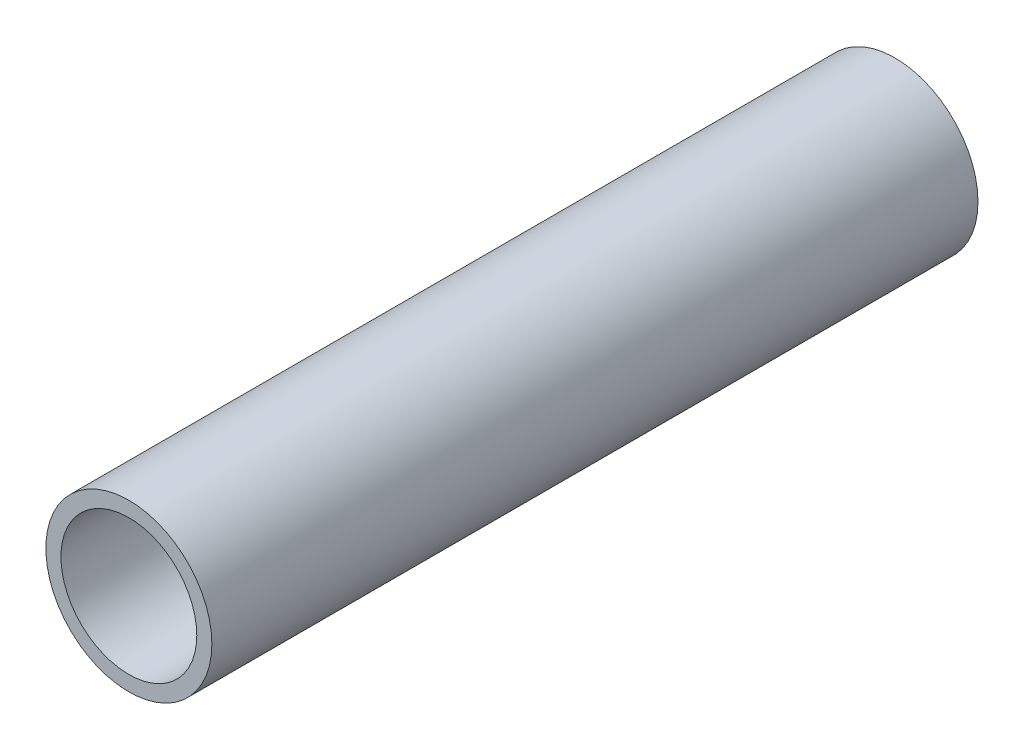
SolidWorks part; units mm, degrees
ref_plane "Front Plane" through (0, 0, 0) normal (0, 0, 1) x (1, 0, 0)
ref_plane "Top Plane" through (0, 0, 0) normal (0, 1, 0) x (1, 0, 0)
ref_plane "Right Plane" through (0, 0, 0) normal (1, 0, 0) x (0, 0, -1)
sketch "Sketch1" plane through (0, 0, 0) normal (0, 0, 1) x (1, 0, 0)
  circle A0 centre (0, 0) radius 7.1438
  circle A1 centre (0, 0) radius 8.7312
  dimension "D1" = 14.2875
  dimension "D2" = 17.4625
extrude "Boss-Extrude1" add sketch "Sketch1" along normal mid plane 80.58
sketch "Sketch2" plane through (0, 0, 40.29) normal (0, 0, 1) x (1, 0, 0)
  circle A0 centre (0, 0) radius 6.25
  circle A1 centre (0, 0) radius 3.175
  dimension "D1" = 12.5
  dimension "D2" = 6.35
extrude "Boss-Extrude2" [suppressed] add sketch "Sketch2" against normal blind 4
ref_plane "Plane1" through (0, 0, 0.29) normal (0, 0, 1) x (1, 0, 0)
sketch "Sketch3" [suppressed] plane through (0, 0, -4.6) normal (0, 0, 1) x (1, 0, 0)
  circle A0 centre (0, 0) radius 4.445
  circle A1 centre (0, 0) radius 3.175
  circle A2 centre (0, 0) radius 6.25 construction
  dimension "D1" = 8.89
  dimension "D2" = 6.35
sketch "Sketch4" plane through (0, 0, 0.29) normal (0, 0, 1) x (1, 0, 0)
  circle A0 centre (0, 0) radius 3.175
  circle A1 centre (0, 0) radius 6.25
  dimension "D1" = 12.5
  dimension "D2" = 6.35
extrude "Boss-Extrude3" [suppressed] add sketch "Sketch4" along normal blind 4
